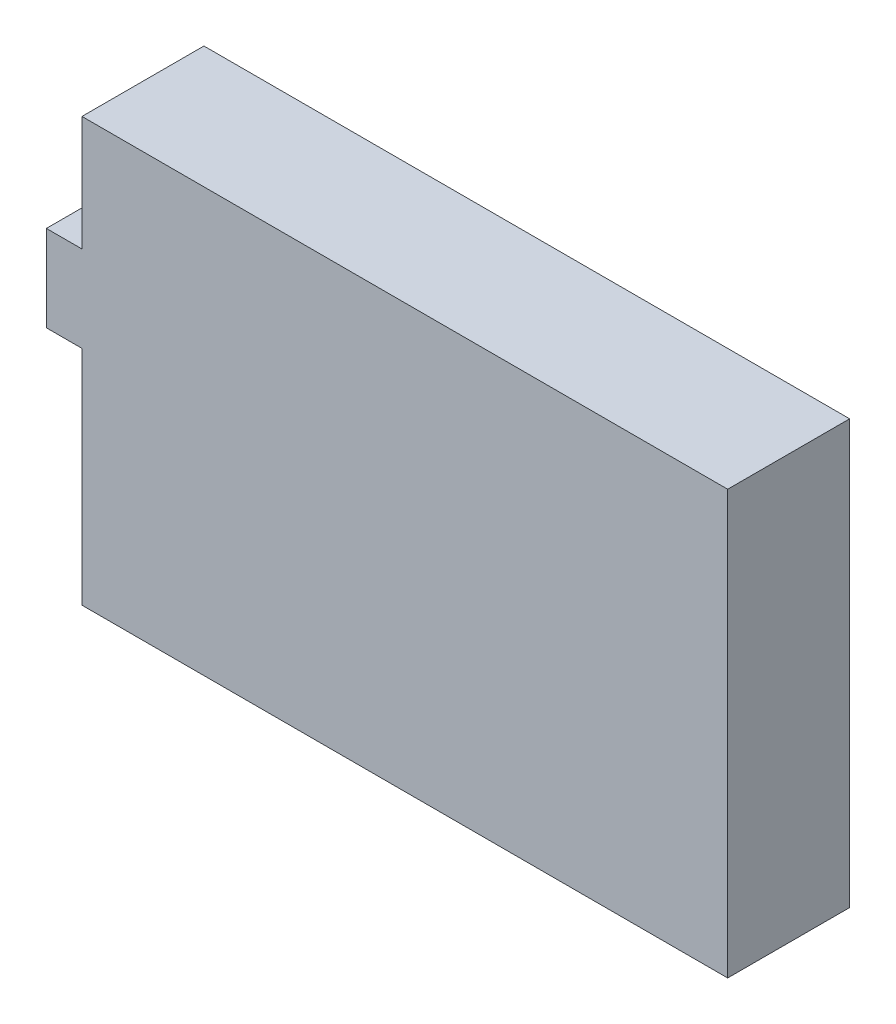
SolidWorks part; units mm, degrees
ref_plane "Ebene vorne" through (0, 0, 0) normal (0, 0, 1) x (1, 0, 0)
ref_plane "Ebene oben" through (0, 0, 0) normal (0, 1, 0) x (1, 0, 0)
ref_plane "Ebene rechts" through (0, 0, 0) normal (1, 0, 0) x (0, 0, -1)
sketch "Skizze1" plane through (0, 0, 0) normal (0, 0, 1) x (1, 0, 0)
  line L8 (-45, 13.2476) -> (45, 13.2476)
  line L9 (-45, 13.2476) -> (-45, -2.7524)
  line L10 (-45, -2.7524) -> (-49.963, -2.7524)
  line L11 (-49.963, -2.7524) -> (-49.963, -14.7524)
  line L12 (-45, -14.7524) -> (-49.963, -14.7524)
  line L13 (-45, -14.7524) -> (-45, -45.7524)
  line L14 (-45, -45.7524) -> (45, -45.7524)
  line L15 (45, 13.2476) -> (45, -45.7524)
  line L16 (0, 0) -> (0, 26.4952) construction
  point P11 (0, 13.2476)
  dimension "D1" = 90
  dimension "D2" = 59
  dimension "D3" = 12
  dimension "D4" = 90
extrude "Aufsatz-Linear austragen1" add sketch "Skizze1" along normal blind 17 contours L15 L14 L13 L12 L11 L10 L9 L8
